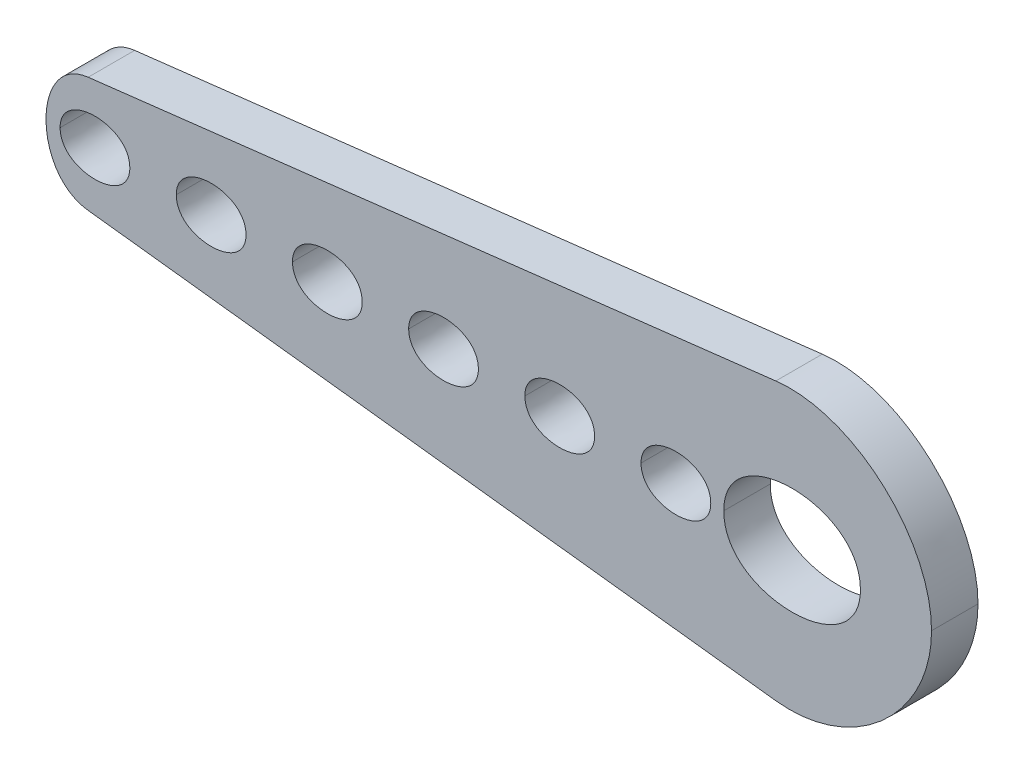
SolidWorks part; units mm, degrees
ref_plane "Front Plane" through (0, 0, 0) normal (0, 0, 1) x (1, 0, 0)
ref_plane "Top Plane" through (0, 0, 0) normal (0, 1, 0) x (1, 0, 0)
ref_plane "Right Plane" through (0, 0, 0) normal (1, 0, 0) x (0, 0, -1)
ref_plane "Plane1" through (0, 0, 2) normal (0, 0, 1) x (1, 0, 0)
sketch "Sketch1" plane through (0, 0, 2) normal (0, 0, 1) x (1, 0, 0)
  spline S0 degree 3 poles (27.5214, -5.959) (30.8889, -6.3543) (34.2215, -3.3244) (34.2214, 0) knots 0 0 0 0 1 1 1 1
  spline S1 degree 3 poles (34.2214, 0) (34.2212, 3.3281) (30.8911, 6.3546) (27.5214, 5.959) knots 0 0 0 0 1 1 1 1
  spline S2 degree 3 poles (27.5214, 5.959) (17.6575, 4.8003) (7.7935, 3.6417) (-2.0703, 2.4829) knots 0 0 0 0 1 1 1 1
  spline S3 degree 3 poles (-2.0703, 2.4829) (-4.4943, 2.1981) (-4.4873, -2.199) (-2.0703, -2.4829) knots 0 0 0 0 1 1 1 1
  spline S4 degree 3 poles (-2.0703, -2.4829) (7.7936, -3.6417) (17.6575, -4.8003) (27.5214, -5.959) knots 0 0 0 0 1 1 1 1
  spline S5 degree 3 poles (25.2814, 0) (25.2814, -3.0788) (31.1614, -3.0788) (31.1614, 0) knots 0 0 0 0 1 1 1 1
  spline S6 degree 3 poles (31.1614, 0) (31.1614, 3.0788) (25.2814, 3.0788) (25.2814, 0) knots 0 0 0 0 1 1 1 1
  spline S7 degree 3 poles (21.7214, 0) (21.7214, -1.5708) (24.7214, -1.5708) (24.7214, 0) knots 0 0 0 0 1 1 1 1
  spline S8 degree 3 poles (24.7214, 0) (24.7214, 1.5708) (21.7214, 1.5708) (21.7214, 0) knots 0 0 0 0 1 1 1 1
  spline S9 degree 3 poles (16.7214, 0) (16.7214, -1.5708) (19.7214, -1.5708) (19.7214, 0) knots 0 0 0 0 1 1 1 1
  spline S10 degree 3 poles (19.7214, 0) (19.7214, 1.5708) (16.7214, 1.5708) (16.7214, 0) knots 0 0 0 0 1 1 1 1
  spline S11 degree 3 poles (11.7214, 0) (11.7214, -1.5708) (14.7214, -1.5708) (14.7214, 0) knots 0 0 0 0 1 1 1 1
  spline S12 degree 3 poles (14.7214, 0) (14.7214, 1.5708) (11.7214, 1.5708) (11.7214, 0) knots 0 0 0 0 1 1 1 1
  spline S13 degree 3 poles (-3.2786, 0) (-3.2786, -1.5708) (-0.2786, -1.5708) (-0.2786, 0) knots 0 0 0 0 1 1 1 1
  spline S14 degree 3 poles (-0.2786, 0) (-0.2786, 1.5708) (-3.2786, 1.5708) (-3.2786, 0) knots 0 0 0 0 1 1 1 1
  spline S15 degree 3 poles (1.7214, 0) (1.7214, -1.5708) (4.7214, -1.5708) (4.7214, 0) knots 0 0 0 0 1 1 1 1
  spline S16 degree 3 poles (4.7214, 0) (4.7214, 1.5708) (1.7214, 1.5708) (1.7214, 0) knots 0 0 0 0 1 1 1 1
  spline S17 degree 3 poles (6.7214, 0) (6.7214, -1.5708) (9.7214, -1.5708) (9.7214, 0) knots 0 0 0 0 1 1 1 1
  spline S18 degree 3 poles (9.7214, 0) (9.7214, 1.5708) (6.7214, 1.5708) (6.7214, 0) knots 0 0 0 0 1 1 1 1
extrude "Boss-Extrude1" add sketch "Sketch1" against normal blind 2
